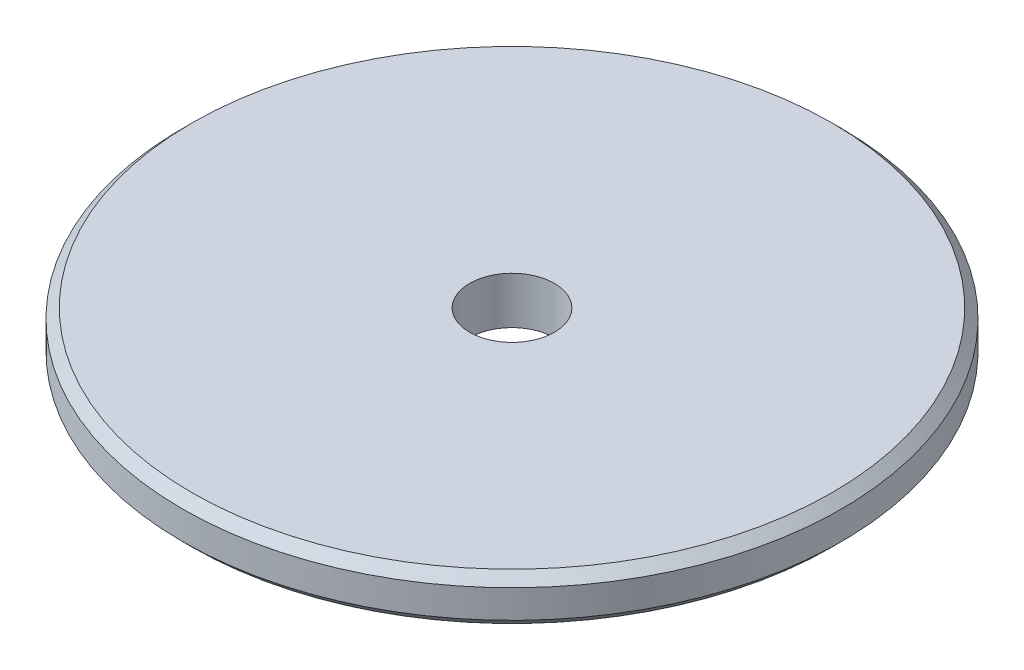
SolidWorks part; units mm, degrees
ref_plane "Front Plane" through (0, 0, 0) normal (0, 0, 1) x (1, 0, 0)
ref_plane "Top Plane" through (0, 0, 0) normal (0, 1, 0) x (1, 0, 0)
ref_plane "Right Plane" through (0, 0, 0) normal (1, 0, 0) x (0, 0, -1)
sketch "Sketch1" plane through (0, 0, 0) normal (0, 1, 0) x (1, 0, 0)
  circle A0 centre (0, 0) radius 35
  circle A1 centre (0, 0) radius 4.5
  dimension "D1" = 9
  dimension "D2" = 70
extrude "Extrude1" add sketch "Sketch1" along normal blind 5
chamfer "Chamfer1" distance 1 angle 45 2 edges at (0, 0, 35) (0, 5, 35)
